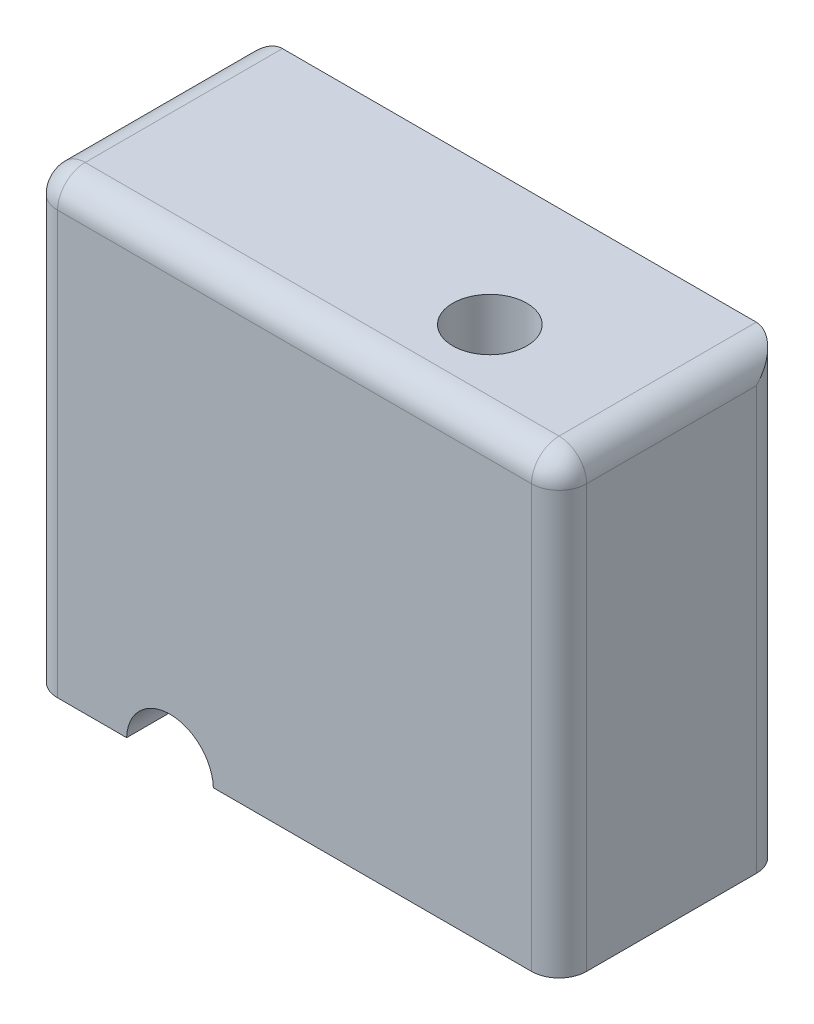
SolidWorks part; units mm, degrees
other "Fillet4"
other "DetailItem1"
other "DetailItem2"
ref_plane "Front Plane" through (0, 0, 0) normal (0, 0, 1) x (1, 0, 0)
ref_plane "Top Plane" through (0, 0, 0) normal (0, 1, 0) x (1, 0, 0)
ref_plane "Right Plane" through (0, 0, 0) normal (1, 0, 0) x (0, 0, -1)
imported_body "Imported1"
ref_plane "Plane1" through (0, -66.8582, 0) normal (0, -1, 0) x (-1, 0, 0)
sketch "Sketch1" plane through (0, -66.8582, 0) normal (0, -1, 0) x (-1, 0, 0)
  line L1 (132.322, -116.7281) -> (-140.8369, -116.7281)
  line L2 (132.322, -116.7281) -> (132.322, 29.4359)
  line L3 (132.322, 29.4359) -> (-140.8369, 29.4359)
  line L4 (-140.8369, -116.7281) -> (-140.8369, 29.4359)
extrude "Cut-Extrude1" cut sketch "Sketch1" along normal through all
